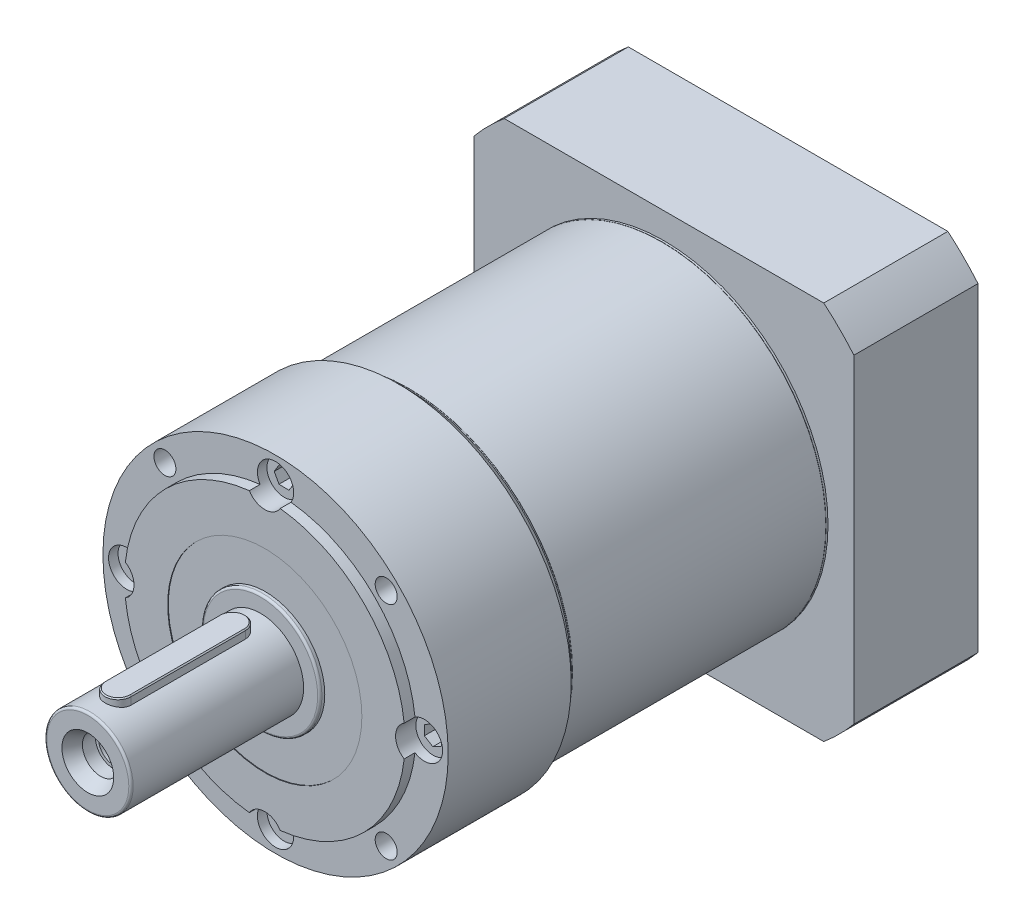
SolidWorks part; units mm, degrees
ref_plane "前视基准面" through (0, 0, 0) normal (0, 0, 1) x (1, 0, 0)
ref_plane "上视基准面" through (0, 0, 0) normal (0, 1, 0) x (1, 0, 0)
ref_plane "右视基准面" through (0, 0, 0) normal (1, 0, 0) x (0, 0, -1)
sketch "草图1" plane through (0, 0, 0) normal (0, 0, 1) x (1, 0, 0)
  circle A0 centre (0, 0) radius 80
extrude "凸台-拉伸1" add sketch "草图1" along normal blind 61.5
sketch "草图2" plane through (0, 0, 61.5) normal (0, 0, 1) x (1, 0, 0)
  circle A0 centre (0, 0) radius 65
extrude "凸台-拉伸2" add sketch "草图2" along normal blind 5
sketch "草图3" plane through (0, 0, 0) normal (0, 0, -1) x (-1, 0, 0)
  circle A0 centre (0, 0) radius 76
extrude "切除-拉伸1" cut sketch "草图3" against normal blind 0.5 flip side to cut
chamfer "倒角1" distance 4 angle 45 1 edges at (-80, 0, 0.5)
sketch "草图4" plane through (0, 0, 66.5) normal (0, 0, 1) x (1, 0, 0)
  line L0 (0, 0) -> (0, -69) construction
  circle A0 centre (0, 0) radius 69 construction
  circle A1 centre (0, -69) radius 8.4
extrude "切除-拉伸2" cut sketch "草图4" against normal blind 19
pattern_circular "阵列(圆周)1" count 4 over 360 about axis through (0, 0, 0) along (0, 0, 1) of "切除-拉伸2"
sketch "草图5" plane through (0, 0, 66.5) normal (0, 0, 1) x (1, 0, 0)
  circle A0 centre (0, 0) radius 27.5
extrude "凸台-拉伸3" add sketch "草图5" along normal blind 2
sketch "草图6" plane through (0, 0, 68.5) normal (0, 0, 1) x (1, 0, 0)
  circle A0 centre (0, 0) radius 20
extrude "凸台-拉伸4" add sketch "草图6" along normal blind 80
fillet "圆角1" radius 1 1 edges at (20, 0, 148.5)
fillet "圆角2" radius 1 1 edges at (27.5, 0, 68.5)
sketch "草图7" plane through (0, 0, 66.5) normal (0, 0, 1) x (1, 0, 0)
  circle A0 centre (0, 0) radius 45
  circle A1 centre (0, 0) radius 27.5
extrude "切除-拉伸3" cut sketch "草图7" against normal blind 0.3
ref_plane "基准面1" through (0, 0, -0.1) normal (0, 0, -1) x (-1, 0, 0)
sketch "草图8" plane through (0, 0, 61.5) normal (0, 0, 1) x (1, 0, 0)
  line L0 (0, 0) -> (0, 72.5)
  line L1 (0, 0) -> (-51.2652, 51.2652)
  circle A0 centre (0, 0) radius 72.5
  dimension "D1" = 45
hole_wizard "M12 螺纹孔1" positions "3D草图1" profile "草图9" tap size "M12" standard "GB"
sketch3d "3D草图1"
  point P0 (-51.2652, 51.2652, 61.5)
sketch "草图9" plane through (-51.2652, 51.2652, 61.5) normal (1, 0, 0) x (0, -1, 0)
  line L0 (0, 0) -> (0, 30.0644)
  line L1 (0, 30.0644) -> (5.1, 27)
  line L2 (5.1, 27) -> (5.1, 0)
  line L5 (5.1, 0) -> (0, 0)
  line L10 (0, 30.0644) -> (-5.1, 27) construction
  line L11 (0, -6.35) -> (0, 107.95) construction
  dimension "螺纹孔钻头直径" = 10.2
  dimension "螺纹孔钻头深度" = 27
  dimension "导头角度" = 118
pattern_circular "阵列(圆周)2" count 4 over 360 about axis through (0, 0, 0) along (0, 0, 1) of "M12 螺纹孔1"
sketch "草图10" plane through (0, 0, -0.1) normal (0, 0, -1) x (-1, 0, 0)
  circle A0 centre (0, 0) radius 76
extrude "凸台-拉伸5" add sketch "草图10" along normal blind 117.4 separate body
ref_plane "基准面2" through (0, 0, -117.6) normal (0, 0, -1) x (-1, 0, 0)
sketch "草图11" plane through (0, 0, -117.6) normal (0, 0, -1) x (-1, 0, 0)
  circle A0 centre (0, 0) radius 76
extrude "凸台-拉伸6" add sketch "草图11" along normal blind 0.9 separate body
sketch "草图12" plane through (0, 0, -118.5) normal (0, 0, -1) x (-1, 0, 0)
  line L1 (-74.0338, 88) -> (74.0338, 88)
  line L2 (-88, 74.0338) -> (-88, -74.0338)
  line L3 (-74.0338, -88) -> (74.0338, -88)
  line L4 (88, 74.0338) -> (88, -74.0338)
  arc A0 (-74.0338, 88) -> (-88, 74.0338) centre (0, 0) ccw
  arc A1 (-88, -74.0338) -> (-74.0338, -88) centre (0, 0) ccw
  arc A2 (74.0338, -88) -> (88, -74.0338) centre (0, 0) ccw
  arc A3 (88, 74.0338) -> (74.0338, 88) centre (0, 0) ccw
  dimension "D1" = 88
  dimension "D3" = 88
extrude "凸台-拉伸7" add sketch "草图12" along normal blind 57.5
sketch "草图13" plane through (0, 0, -176) normal (0, 0, -1) x (-1, 0, 0)
  circle A0 centre (0, 0) radius 57.15
extrude "切除-拉伸4" cut sketch "草图13" against normal blind 7
sketch "草图14" plane through (0, 0, -169) normal (0, 0, -1) x (-1, 0, 0)
  circle A0 centre (0, 0) radius 55
extrude "切除-拉伸5" cut sketch "草图14" against normal blind 25
sketch "草图15" plane through (0, 0, -144) normal (0, 0, -1) x (-1, 0, 0)
  circle A0 centre (0, 0) radius 50
extrude "切除-拉伸6" cut sketch "草图15" against normal blind 30.5
sketch "草图16" plane through (0, 0, -176) normal (0, 0, -1) x (-1, 0, 0)
  line L0 (0, 0) -> (0, -67.5) construction
  circle A0 centre (0, 0) radius 67.5 construction
  circle A1 centre (0, -67.5) radius 7
extrude "切除-拉伸7" cut sketch "草图16" against normal blind 11
pattern_circular "阵列(圆周)3" count 4 over 360 about axis through (0, 0, 0) along (0, 0, 1) of "切除-拉伸7"
sketch "草图17" plane through (0, 0, -176) normal (0, 0, -1) x (-1, 0, 0)
  line L0 (0, 0) -> (-81.3173, 81.3173)
  circle A0 centre (0, 0) radius 100
  arc A1 (-74.0338, 88) -> (-88, 74.0338) centre (0, 0) ccw construction
hole_wizard "M8 螺纹孔1" positions "3D草图2" profile "草图18" tap size "M8" standard "GB"
sketch3d "3D草图2"
  line L0 (0, 0, -176) -> (81.3173, 81.3173, -176) construction
  circle A0 centre (0, 0, -176) radius 100 construction
  point P0 (70.7107, 70.7107, -176)
  point P6 (0, 0, -276)
sketch "草图18" plane through (70.7107, 70.7107, -176) normal (1, 0, 0) x (0, 1, 0)
  line L0 (0, 0) -> (0, 31.0429)
  line L1 (0, 31.0429) -> (3.4, 29)
  line L2 (3.4, 29) -> (3.4, 0)
  line L5 (3.4, 0) -> (0, 0)
  line L10 (0, 31.0429) -> (-3.4, 29) construction
  line L11 (0, -6.35) -> (0, 107.95) construction
  dimension "螺纹孔钻头直径" = 6.8
  dimension "螺纹孔钻头深度" = 29
  dimension "导头角度" = 118
pattern_circular "阵列(圆周)4" count 4 over 360 about axis through (0, 0, 0) along (0, 0, 1) of "M8 螺纹孔1"
sketch "草图19" plane through (0, 0, 47.5) normal (0, 0, 1) x (1, 0, 0)
  line L1 (2.4055, 72.943) -> (-2.212, 73.0547)
  line L2 (-2.212, 73.0547) -> (-4.6175, 69.1117)
  line L3 (-4.6175, 69.1117) -> (-2.4055, 65.057)
  line L4 (-2.4055, 65.057) -> (2.212, 64.9453)
  line L5 (2.212, 64.9453) -> (4.6175, 68.8883)
  line L6 (4.6175, 68.8883) -> (2.4055, 72.943)
  circle A0 centre (0, 69) radius 8
  circle A1 centre (0, 69) radius 4 construction
  dimension "D1" = 8
extrude "凸台-拉伸8" add sketch "草图19" along normal blind 10
pattern_circular "阵列(圆周)5" count 4 over 360 about axis through (0, 0, 0) along (0, 0, 1) of "凸台-拉伸8"
sketch "草图20" plane through (0, 0, -165) normal (0, 0, -1) x (-1, 0, 0)
  line L1 (1.7033, 70.5164) -> (-1.7607, 70.4833)
  line L2 (-1.7607, 70.4833) -> (-3.4639, 67.4669)
  line L3 (-3.4639, 67.4669) -> (-1.7033, 64.4836)
  line L4 (-1.7033, 64.4836) -> (1.7607, 64.5167)
  line L5 (1.7607, 64.5167) -> (3.4639, 67.5331)
  line L6 (3.4639, 67.5331) -> (1.7033, 70.5164)
  circle A0 centre (0, 67.5) radius 6.5
  circle A1 centre (0, 67.5) radius 3 construction
  dimension "D1" = 6
extrude "凸台-拉伸9" add sketch "草图20" along normal blind 8
pattern_circular "阵列(圆周)6" count 4 over 360 about axis through (0, 0, 0) along (0, 0, 1) of "凸台-拉伸9"
ref_plane "基准面3" through (0, 0, -143) normal (0, 0, -1) x (-1, 0, 0)
sketch "草图21" plane through (0, 0, -143) normal (0, 0, -1) x (-1, 0, 0)
  circle A0 centre (0, 0) radius 37.5
extrude "凸台-拉伸10" add sketch "草图21" against normal up to surface (29.5 mm away)
chamfer "倒角2" distance 1.5 angle 45 1 edges at (-37.5, 0, -143)
sketch "草图22" plane through (0, 0, -176) normal (0, 0, -1) x (-1, 0, 0)
  circle A0 centre (0, 0) radius 17.5
extrude "切除-拉伸8" cut sketch "草图22" against normal blind 86
sketch "草图23" plane through (0, 0, -143) normal (0, 0, -1) x (-1, 0, 0)
  line L1 (-43.0001, 0.5) -> (42.7283, 0.5)
  line L2 (-43.0001, 0.5) -> (-43.0001, -0.5)
  line L3 (-43.0001, -0.5) -> (42.7283, -0.5)
  line L4 (42.7283, 0.5) -> (42.7283, -0.5)
  dimension "D1" = 0.5
  dimension "D2" = 1
extrude "切除-拉伸9" cut sketch "草图23" against normal up to surface (29.5 mm away)
sketch "草图24" plane through (0, 0, 0) normal (0, 1, 0) x (1, 0, 0)
  line L0 (-6, -134.5) -> (-6, -81.5)
  line L1 (6, -134.5) -> (6, -81.5)
  line L2 (-19, -148.5) -> (19, -148.5) construction
  arc A0 (-6, -134.5) -> (6, -134.5) centre (0, -134.5) ccw
  arc A1 (6, -81.5) -> (-6, -81.5) centre (0, -81.5) ccw
  dimension "D1" = 14
  dimension "D2" = 53
extrude "凸台-拉伸11" add sketch "草图24" along normal blind 23
chamfer "倒角3" distance 0.5 angle 45 4 edges at (6, 23, 108) (0, 23, 75.5) (0, 23, 140.5) (-6, 23, 108)
sketch "草图25" plane through (0, 0, 148.5) normal (0, 0, 1) x (1, 0, 0)
  circle A0 centre (0, 0) radius 8.5
extrude "切除-拉伸10" cut sketch "草图25" against normal blind 12
sketch "草图26" plane through (0, 0, 148.5) normal (0, 0, 1) x (1, 0, 0)
  circle A0 centre (0, 0) radius 12
ref_plane "基准面4" through (0, 0, 142.5) normal (0, 0, 1) x (1, 0, 0)
sketch "草图27" plane through (0, 0, 142.5) normal (0, 0, 1) x (1, 0, 0)
  circle A0 centre (0, 0) radius 8.5 construction
  circle A1 centre (0, 0) radius 8.5
loft "切除-放样1" cut profiles "草图27", "草图26"
hole_wizard "M16 螺纹孔1" positions "3D草图3" profile "草图28" tap size "M16" standard "GB"
sketch3d "3D草图3"
  line L0 (0, 0, 136.5) -> (0, 0, 142.5) construction
  point P0 (0, 0, 136.5)
sketch "草图28" plane through (0, 0, 136.5) normal (1, 0, 0) x (0, -1, 0)
  line L0 (0, 0) -> (0, 38.206)
  line L1 (0, 38.206) -> (7, 34)
  line L2 (7, 34) -> (7, 0)
  line L5 (7, 0) -> (0, 0)
  line L10 (0, 38.206) -> (-7, 34) construction
  line L11 (0, -6.35) -> (0, 107.95) construction
  dimension "螺纹孔钻头直径" = 14
  dimension "螺纹孔钻头深度" = 34
  dimension "导头角度" = 118
